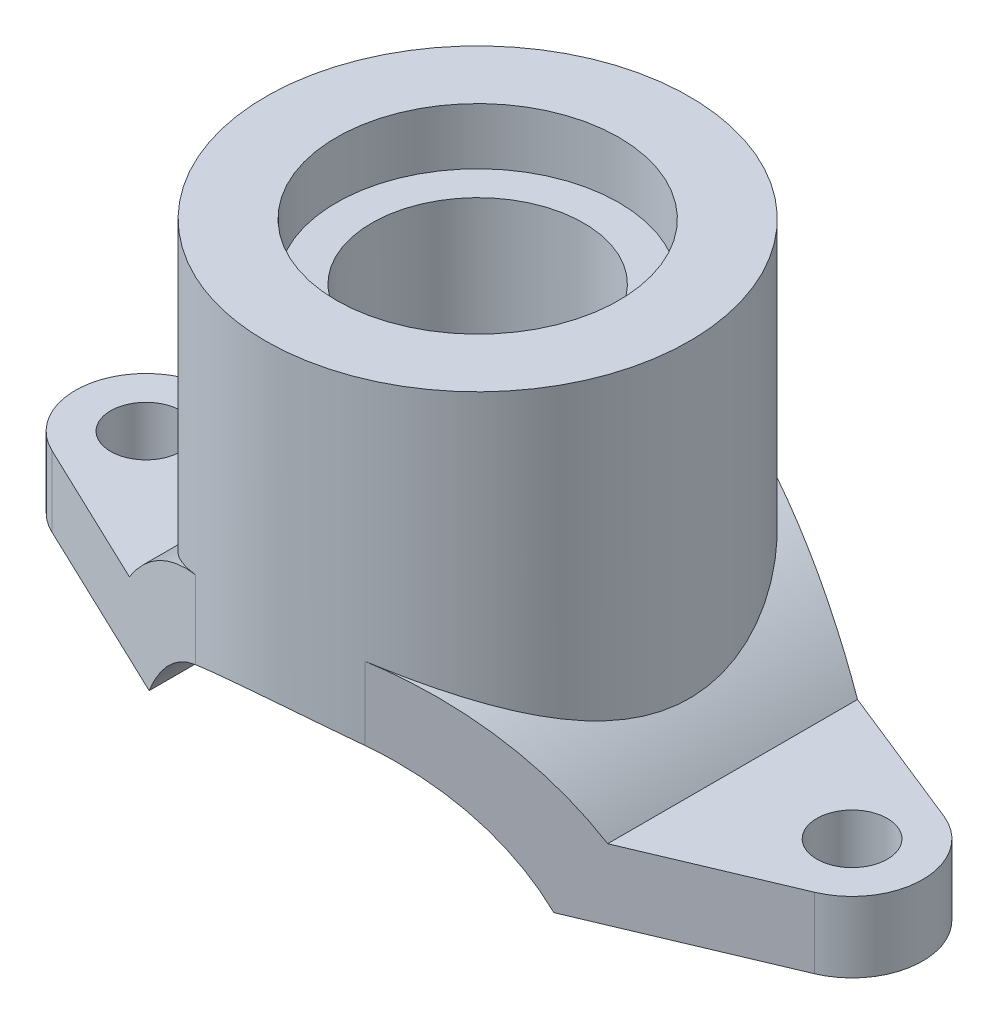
SolidWorks part; units mm, degrees
ref_plane "Front Plane" through (0, 0, 0) normal (0, 0, 1) x (1, 0, 0)
ref_plane "Top Plane" through (0, 0, 0) normal (0, 1, 0) x (1, 0, 0)
ref_plane "Right Plane" through (0, 0, 0) normal (1, 0, 0) x (0, 0, -1)
sketch "Sketch2" plane through (0, 0, 0) normal (0, 0, 1) x (1, 0, 0)
  line L0 (-150, 0) -> (-69.8498, 0)
  line L1 (69.8498, 0) -> (150, 0)
  line L2 (-150, 25) -> (-83.2406, 25)
  line L3 (83.2406, 25) -> (150, 25)
  line L4 (-150, 25) -> (-150, 0)
  line L5 (150, 25) -> (150, 0)
  arc A0 (-69.8498, 0) -> (69.8498, 0) centre (0, -39) cw
  arc A1 (-83.2406, 25) -> (83.2406, 25) centre (0, -39) cw
  dimension "D3" = 39
  dimension "D4" = 80
  dimension "D6" = 300
  dimension "D5" = 25
extrude "Boss-Extrude1" add sketch "Sketch2" along normal mid plane 150
ref_plane "Plane1" through (0, 66, 75) normal (0, 1, 0) x (1, 0, 0)
sketch "Sketch3" plane through (0, 66, 75) normal (0, 1, 0) x (1, 0, 0)
  line L0 (-150, 0) -> (-150, 150) construction
  line L3 (150, 0) -> (150, 150) construction
  line L5 (83.2406, 150) -> (-83.2406, 150) construction
  line L6 (-135.3037, 98.9835) -> (-37.2612, 143.3337)
  line L7 (21.5637, 144.612) -> (134.3046, 99.404)
  line L8 (134.727, 53.1699) -> (22.8309, 5.9097)
  line L9 (-135.7645, 53.6418) -> (-38.6434, 7.3085)
  arc A0 (-135.3037, 98.9835) -> (-135.7645, 53.6418) centre (-125, 76.2056) ccw
  arc A1 (134.727, 53.1699) -> (134.3046, 99.404) centre (125, 76.2) ccw
  arc A2 (-38.6434, 7.3085) -> (22.8309, 5.9097) centre (-6.35, 75) ccw
  arc A3 (21.5637, 144.612) -> (-37.2612, 143.3337) centre (-6.35, 75) ccw
  dimension "D1" = 25
  dimension "D2" = 75
  dimension "D3" = 250
extrude "Cut-Extrude1" cut sketch "Sketch3" against normal through all flip side to cut
ref_plane "Plane2" through (0, 150, 0) normal (0, 1, 0) x (1, 0, 0)
sketch "Sketch4" plane through (0, 150, 0) normal (0, 1, 0) x (1, 0, 0)
  circle A0 centre (-6.35, 0) radius 75
  arc A1 (-38.6434, -67.6915) -> (22.8309, -69.0903) centre (-6.35, 0) ccw construction
  dimension "D1" = 150
extrude "Boss-Extrude2" add sketch "Sketch4" against normal up to surface (84.1922 mm away)
sketch "Sketch5" plane through (0, 0, 0) normal (0, 0, 1) x (1, 0, 0)
  line L0 (-6.35, 150) -> (43.65, 150)
  line L1 (68.65, 150) -> (-81.35, 150) construction
  line L2 (43.65, 150) -> (43.65, 130)
  line L3 (43.65, 130) -> (31.15, 130)
  line L4 (31.15, 130) -> (31.15, 20)
  line L5 (31.15, 20) -> (-6.35, 20)
  line L6 (-6.35, 20) -> (-6.35, 150)
  line L7 (-6.35, 177.8) -> (-6.35, 0) construction
  dimension "D1" = 130
  dimension "D2" = 100
  dimension "D3" = 75
  dimension "D4" = 20
revolve "Cut-Revolve1" cut sketch "Sketch5" angle 360 about L7
sketch "Sketch6" plane through (0, 25, 0) normal (0, 1, 0) x (1, 0, 0)
  circle A0 centre (-125, 1.2056) radius 12.5
  circle A1 centre (125, 1.2) radius 12.5
extrude "Cut-Extrude2" cut sketch "Sketch6" against normal through all
